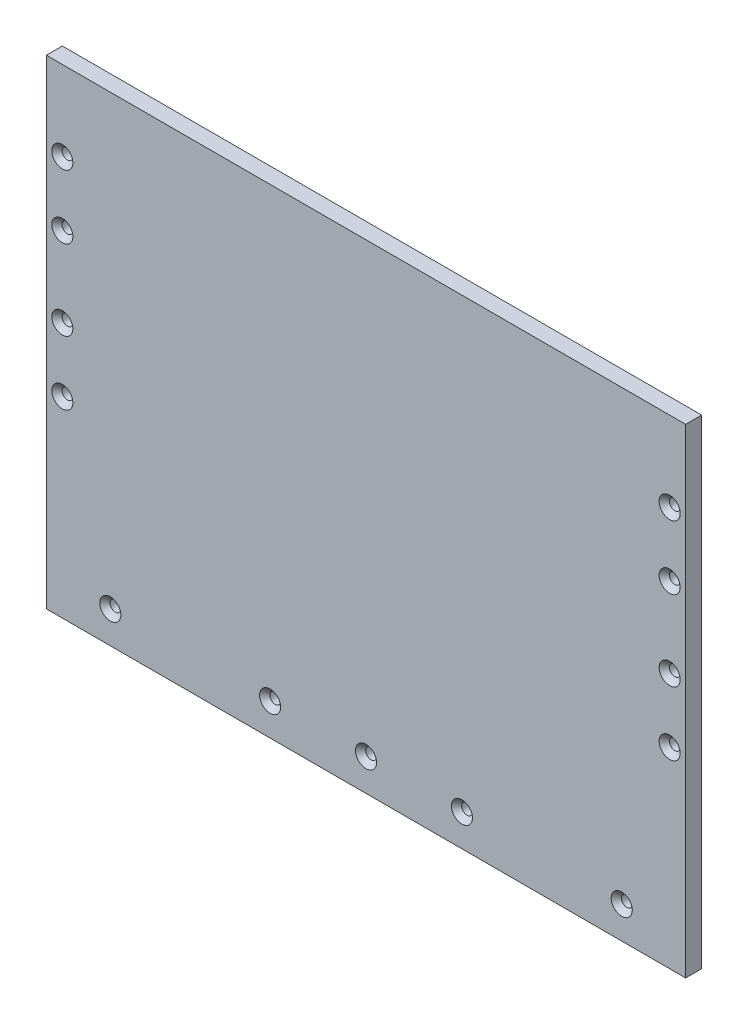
SolidWorks part; units mm, degrees
ref_plane "前视基准面" through (0, 0, 0) normal (0, 0, 1) x (1, 0, 0)
ref_plane "上视基准面" through (0, 0, 0) normal (0, 1, 0) x (1, 0, 0)
ref_plane "右视基准面" through (0, 0, 0) normal (1, 0, 0) x (0, 0, -1)
other "Configuration Table"
sketch "草图1" plane through (0, 0, 0) normal (0, 0, 1) x (1, 0, 0)
  line L1 (-100, 75) -> (100, 75)
  line L2 (-100, 75) -> (-100, -75)
  line L3 (-100, -75) -> (100, -75)
  line L4 (100, 75) -> (100, -75)
  line L5 (-100, 75) -> (100, -75) construction
  line L6 (-100, -75) -> (100, 75) construction
  point P0 (0, 0)
  dimension "D1" = 200
  dimension "D2" = 150
extrude "凸台-拉伸1" add sketch "草图1" along normal blind 5
hole_wizard "M3 十字槽沉头木螺钉的锥形沉头孔1" positions "草图2" profile "草图3" countersink size "M3" standard "GB"
sketch "草图2" plane through (0, 0, 5) normal (0, 0, 1) x (1, 0, 0)
  line L0 (-100, 75) -> (-100, -75) construction
  line L1 (100, 75) -> (-100, 75) construction
  line L2 (-100, -75) -> (100, -75) construction
  line L3 (100, -75) -> (100, 75) construction
  point P0 (-95, 50)
  point P2 (-95, 30)
  point P4 (-95, 5)
  point P6 (-95, -15)
  point P8 (-80, -65)
  point P10 (95, 50)
  point P12 (95, 30)
  point P14 (95, 5)
  point P16 (95, -15)
  point P18 (80, -65)
  point P20 (-30, -65)
  point P22 (0, -65)
  point P24 (30, -65)
  dimension "D1" = 5
  dimension "D2" = 25
  dimension "D3" = 5
  dimension "D4" = 20
  dimension "D5" = 5
  dimension "D6" = 5
  dimension "D7" = 20
  dimension "D8" = 60
  dimension "D9" = 20
  dimension "D10" = 10
  dimension "D11" = 10
  dimension "D12" = 10
  dimension "D13" = 10
  dimension "D14" = 100
  dimension "D15" = 30
  dimension "D16" = 30
  dimension "D17" = 10
  dimension "D18" = 20
  dimension "D19" = 5
  dimension "D20" = 5
  dimension "D21" = 5
  dimension "D22" = 5
  dimension "D23" = 25
  dimension "D24" = 45
  dimension "D25" = 60
  dimension "D26" = 20
sketch "草图3" plane through (-95, 50, 5) normal (1, 0, 0) x (0, -1, 0)
  line L0 (0, 0) -> (0, 12.5215)
  line L1 (0, 12.5215) -> (1.7, 11.5)
  line L2 (1.7, 11.5) -> (1.7, 1.6)
  line L3 (1.7, 1.6) -> (3.3, 0)
  line L5 (3.3, 0) -> (0, 0)
  line L6 (-1.7, 1.6) -> (-3.3, 0) construction
  line L10 (0, 12.5215) -> (-1.7, 11.5) construction
  line L11 (0, -6.35) -> (0, 107.95) construction
  dimension "孔直径" = 3.4
  dimension "孔深度" = 11.5
  dimension "近端锥形沉头孔直径" = 6.6
  dimension "近端锥形沉头孔角度" = 90
  dimension "导头角度" = 118
